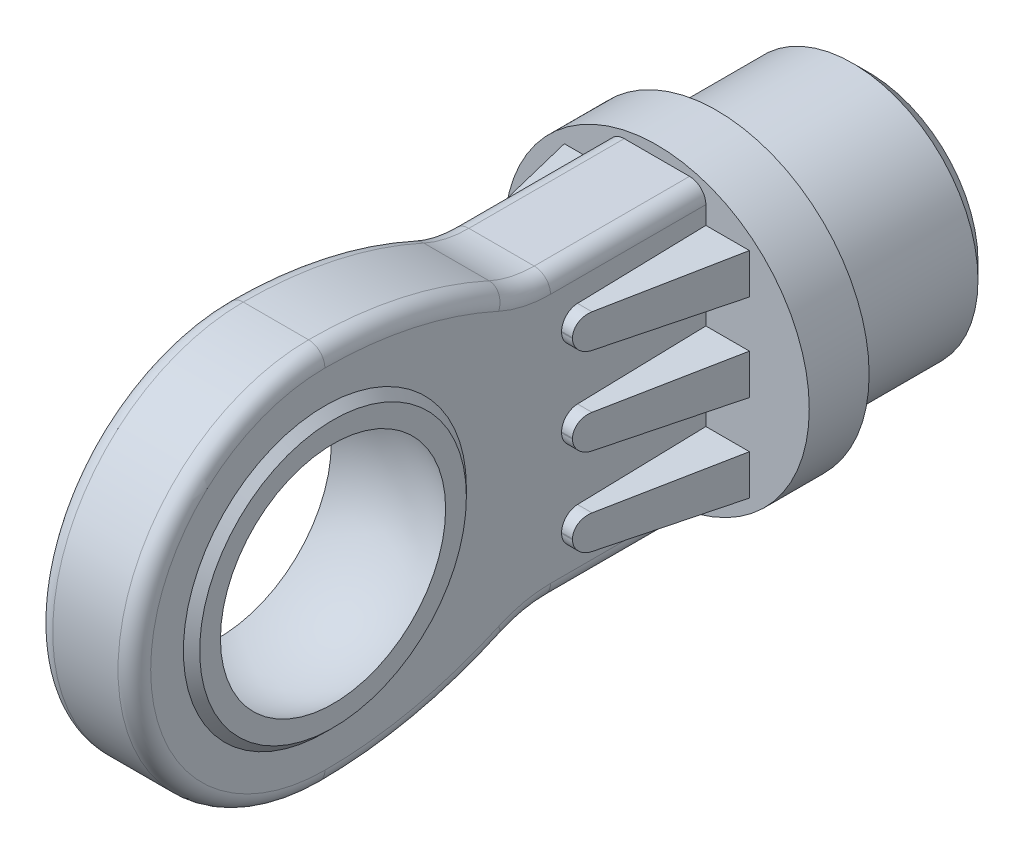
SolidWorks part; units mm, degrees
ref_plane "Plan1" through (0, 0, 0) normal (0, 0, 1) x (1, 0, 0)
ref_plane "Plan2" through (0, 0, 0) normal (0, 1, 0) x (1, 0, 0)
ref_plane "Plan3" through (0, 0, 0) normal (1, 0, 0) x (0, 0, -1)
sketch "Esquisse1" plane through (0, 0, 0) normal (0, 0, 1) x (1, 0, 0)
  arc A2 (-11.4046, 1.4785) -> (-1.4785, 11.4046) centre (0, 0) ccw
  circle A3 centre (0, 0) radius 11.5
  dimension "D1" = 0.5
extrude "Base-Extrusion" add sketch "Esquisse1" against normal blind 14
sketch "Esquisse2" plane through (0, 0, 0) normal (0, 0, 1) x (1, 0, 0)
  circle A3 centre (0, 0) radius 14
extrude "Boss.-Extru.1" add sketch "Esquisse2" along normal blind 5.5
chamfer "Chanfrein1" distance 1.5 angle 45
sketch "Esquisse4" plane through (0, 0, 0) normal (1, 0, 0) x (0, 0, -1)
  line L0 (-64.3122, 0) -> (32.1557, 0) construction
  line L1 (-5.5, -13) -> (-19.7696, -13)
  line L2 (12.5, 0) -> (0, 0) construction
  line L3 (-40.5, 31.274) -> (-40.5, -67.6861) construction
  line L4 (-5.5, 14) -> (-5.5, -14) construction
  line L5 (-60, -22.5) -> (-20, -22.5) construction
  line L6 (-5.5, 13) -> (-19.7696, 13)
  line L7 (-5.5, 13) -> (-5.5, -13)
  arc A0 (-40.5, 17.5) -> (-40.5, -17.5) centre (-40.5, 0) ccw
  arc A1 (-19.7696, 13) -> (-23.9157, 13.9) centre (-19.7696, 23) cw
  arc A2 (-19.7696, -13) -> (-23.9157, -13.9) centre (-19.7696, -23) ccw
  arc A3 (-23.9157, 13.9) -> (-40.5, 17.5) centre (-40.5, -22.5) ccw
  arc A4 (-23.9157, -13.9) -> (-40.5, -17.5) centre (-40.5, 22.5) cw
  dimension "D2" = 35
  dimension "D5" = 10
  dimension "D1" = 35
  dimension "D3" = 22.5
  dimension "D4" = 13
extrude "Boss.-Extru.2" add sketch "Esquisse4" along normal blind 4.5
sketch "Esquisse5" plane through (4.5, 0, 0) normal (1, 0, 0) x (0, 0, -1)
  circle A0 centre (-40.5, 0) radius 13
  dimension "D1" = 26
extrude "Boss.-Extru.3" add sketch "Esquisse5" along normal blind 0.75 draft 45
fillet "Congé12" radius 1.5
mirror "Symétrie1" about plane through (0, 0, 0) normal (1, 0, 0)
sketch "Esquisse7" plane through (0, 0, 0) normal (1, 0, 0) x (0, 0, -1)
  line L0 (-28.9, 0) -> (-52.1, 0)
  line L2 (-28.9, 0) -> (-15.8462, 0) construction
  line L3 (12.5, 0) -> (0, 0) construction
  arc A0 (-28.9, 0) -> (-52.1, 0) centre (-40.5, 0) ccw
  dimension "D1" = 23.2
revolve "Enlèvement de matière-Révolution1" cut sketch "Esquisse7" angle 360 about L2
ref_plane "Plan4" through (0, -8, 0) normal (0, 1, 0) x (-1, 0, 0)
sketch "Esquisse9" plane through (0, -8, 0) normal (0, 1, 0) x (-1, 0, 0)
  line L0 (-8.5, 5.5) -> (-5.5, 18.75)
  line L1 (14, 5.5) -> (-14, 5.5) construction
  line L2 (-5.5, 18.75) -> (-4.5, 18.75)
  line L3 (-4.5, 5.5) -> (-4.5, 19.7696) construction
  dimension "D1" = 1
  dimension "D2" = 13.25
  dimension "D3" = 4
rib "Nervure2" sketch "Esquisse9" sketch "Esquisse9" thickness 3 extrusion direction parallel to sketch draft on yes draft angle 1.5 parameters "D1"=3, "D3"=1.5
pattern_linear "Répétition linéaire2" count 3 spacing 8
mirror "Symétrie4" about plane through (0, 0, 0) normal (1, 0, 0)
fillet "Congé13" radius 1.5
